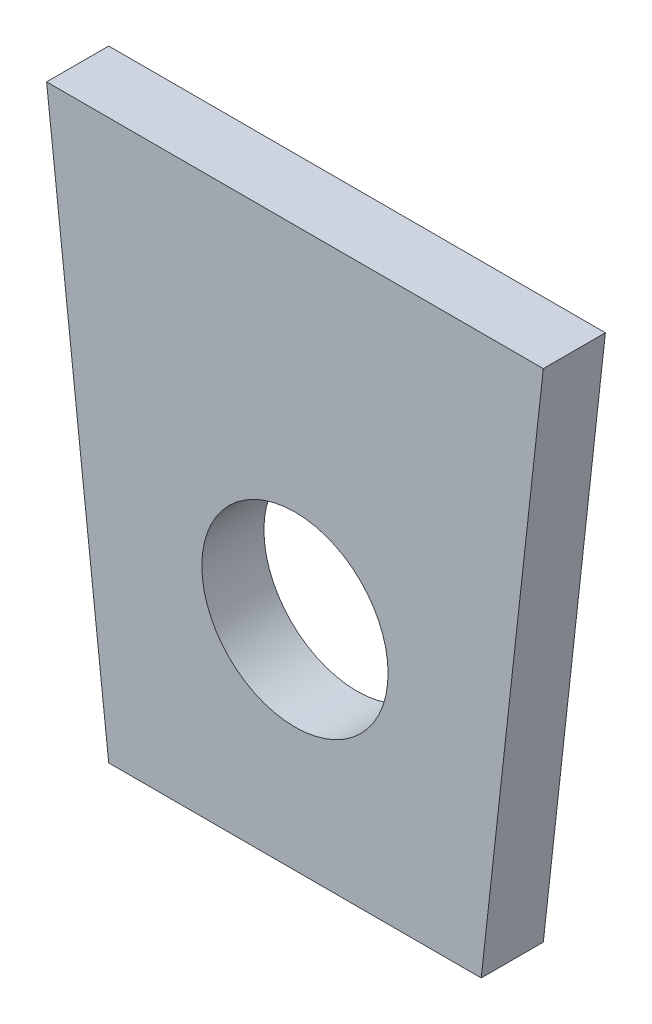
SolidWorks part; units mm, degrees
ref_plane "前视基准面" through (0, 0, 0) normal (0, 0, 1) x (1, 0, 0)
ref_plane "上视基准面" through (0, 0, 0) normal (0, 1, 0) x (1, 0, 0)
ref_plane "右视基准面" through (0, 0, 0) normal (1, 0, 0) x (0, 0, -1)
sketch "草图1" plane through (0, 0, 0) normal (0, 0, 1) x (1, 0, 0)
  line L0 (-40, 0) -> (40, 0)
  line L1 (40, 0) -> (30, -90)
  line L2 (30, -90) -> (-30, -90)
  line L3 (-30, -90) -> (-40, 0)
  line L4 (0, -55) -> (0, 0) construction
  circle A0 centre (0, -55) radius 15
  dimension "D6" = 55
  dimension "D7" = 30
  dimension "D1" = 80
  dimension "D2" = 60
  dimension "D3" = 90
  dimension "D4" = 30
  dimension "D5" = 40
extrude "拉伸1" add sketch "草图1" along normal blind 10
